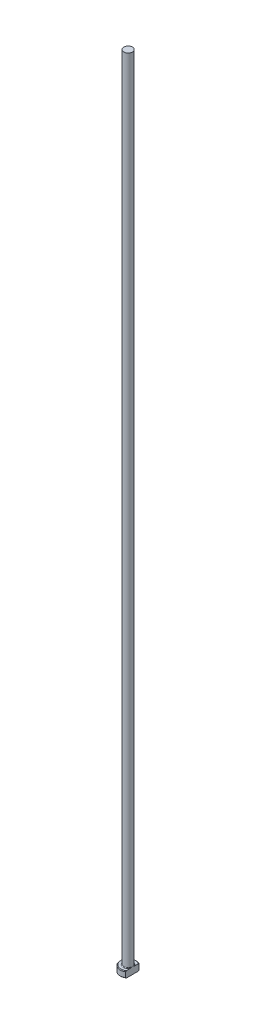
SolidWorks part; units mm, degrees
ref_plane "Front Plane" through (0, 0, 0) normal (0, 0, 1) x (1, 0, 0)
ref_plane "Top Plane" through (0, 0, 0) normal (0, 1, 0) x (1, 0, 0)
ref_plane "Right Plane" through (0, 0, 0) normal (1, 0, 0) x (0, 0, -1)
sketch "Sketch1" plane through (0, 0, 0) normal (0, 0, 1) x (1, 0, 0)
  line L0 (0, 259.9588) -> (0, -15.1925) construction
  line L1 (0, 0) -> (-2.5, 0)
  line L2 (-2.5, 0) -> (-2.5, 2)
  line L3 (-2.5, 2) -> (-1.35, 2)
  line L4 (-1.35, 2) -> (-1.35, 250)
  line L5 (-1.35, 250) -> (0, 250)
  line L6 (0, 250) -> (0, 0)
  dimension "L" = 250
  dimension "H" = 5
  dimension "T" = 2
  dimension "D" = 2.7
revolve "Revolve1" add sketch "Sketch1" angle 360 about L0
chamfer "Chamfer1" distance 0.2 angle 45 2 edges at (0, 2, 2.5) (0, 0, 2.5)
fillet "Fillet1" radius 0.2 1 edges at (0, 2, 1.35)
sketch "Sketch2" plane through (0, 0, 0) normal (0, 1, 0) x (1, 0, 0)
  line L0 (1.35, 2.1042) -> (1.35, -2.1042)
  circle A0 centre (0, 0) radius 2.5 construction
  arc A1 (1.35, -2.1042) -> (1.35, 2.1042) centre (0, 0) ccw
  circle A2 centre (0, 0) radius 1.35 construction
extrude "KEY" cut sketch "Sketch2" along normal through all
